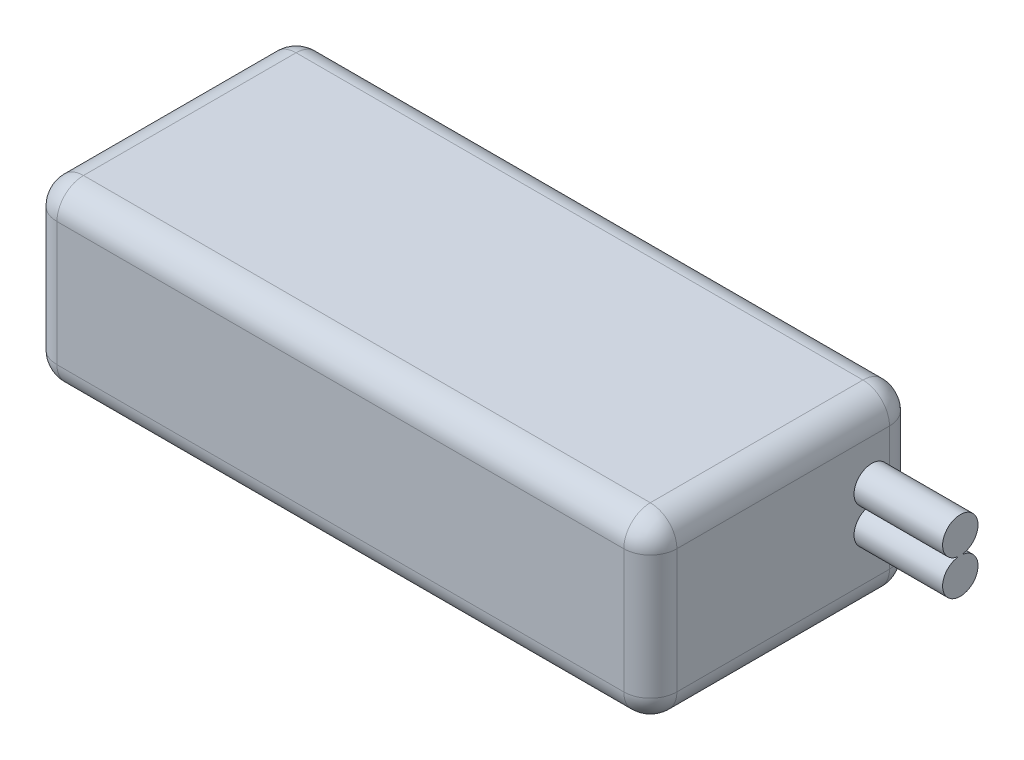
SolidWorks part; units mm, degrees
ref_plane "Front Plane" through (0, 0, 0) normal (0, 0, 1) x (1, 0, 0)
ref_plane "Top Plane" through (0, 0, 0) normal (0, 1, 0) x (1, 0, 0)
ref_plane "Right Plane" through (0, 0, 0) normal (1, 0, 0) x (0, 0, -1)
sketch "Sketch2" plane through (0, 0, 0) normal (0, 1, 0) x (1, 0, 0)
  line L1 (0, 0) -> (70, 0)
  line L2 (0, 0) -> (0, 30)
  line L3 (0, 30) -> (70, 30)
  line L4 (70, 0) -> (70, 30)
  dimension "D1" = 70
  dimension "D2" = 30
extrude "Boss-Extrude1" add sketch "Sketch2" along normal blind 20
fillet "Fillet1" radius 3 12 edges at (0, 10, 0) (70, 10, 0) (35, 0, 0) (70, 0, -15) (70, 10, -30) (35, 0, -30) (0, 10, -30) (0, 0, -15) (0, 20, -15) (35, 20, -30) (70, 20, -15) (35, 20, 0)
sketch "Sketch4" plane through (70, 0, 0) normal (1, 0, 0) x (0, 0, -1)
  line L5 (27, 3) -> (27, 17) construction
  line L8 (24.678, 10.367) -> (24.678, 10.3148)
  line L10 (25.322, 10.367) -> (25.322, 10.3148)
  arc A0 (25.322, 10.367) -> (24.678, 10.367) centre (25, 12.3409) ccw
  arc A1 (24.678, 10.3148) -> (25.322, 10.3148) centre (25, 8.3409) ccw
  point P6 (25, 10.3409)
  dimension "D1" = 4
  dimension "D2" = 4
  dimension "D3" = 2
extrude "Boss-Extrude3" add sketch "Sketch4" along normal blind 10
